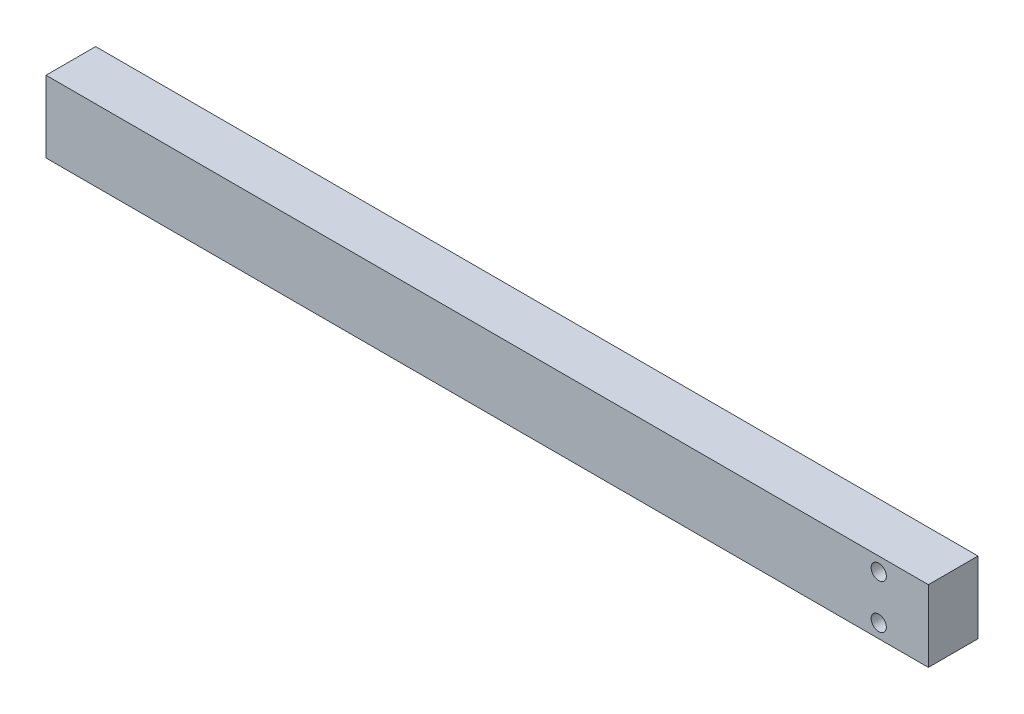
SolidWorks part; units mm, degrees
ref_plane "Face" through (0, 0, 0) normal (0, 0, 1) x (1, 0, 0)
ref_plane "Dessus" through (0, 0, 0) normal (0, 1, 0) x (1, 0, 0)
ref_plane "Droite" through (0, 0, 0) normal (1, 0, 0) x (0, 0, -1)
sketch "Esquisse1" plane through (0, 0, 0) normal (0, 0, 1) x (1, 0, 0)
  line L1 (0, 0) -> (320, 0)
  line L2 (0, 0) -> (0, 26)
  line L3 (0, 26) -> (320, 26)
  line L4 (320, 0) -> (320, 26)
  dimension "D1" = 320
  dimension "D2" = 26
extrude "Extrusion1" add sketch "Esquisse1" along normal blind 18
hole_wizard "Dégagement M51" positions "Esquisse3" profile "Esquisse2" hole size "M5" standard "ISO"
sketch "Esquisse3" plane through (0, 0, 18) normal (0, 0, 1) x (1, 0, 0)
  line L0 (320, 26) -> (0, 26) construction
  line L1 (0, 0) -> (320, 0) construction
  line L2 (320, 0) -> (320, 26) construction
  point P0 (302, 5)
  point P1 (302, 21)
  dimension "D1" = 5
  dimension "D2" = 5
  dimension "D3" = 18
  dimension "D4" = 18
sketch "Esquisse2" plane through (302, 5, 18) normal (1, 0, 0) x (0, -1, 0)
  line L0 (0, 0) -> (0, 18)
  line L1 (0, 18) -> (2.75, 18)
  line L2 (2.75, 18) -> (2.75, 0)
  line L5 (2.75, 0) -> (0, 0)
  line L11 (0, -6.35) -> (0, 107.95) construction
  dimension "Diamètre du perçage jusqu'au prochain" = 5.5
  dimension "Profondeur du perçage jusqu'au prochain" = 18
hole_wizard "Trou taraudé M61" positions "Esquisse5" profile "Esquisse4" tap size "M6" standard "ISO"
sketch "Esquisse5" plane through (0, 0, 0) normal (-1, 0, 0) x (0, 0, 1)
  line L0 (0, 26) -> (0, 0) construction
  line L3 (18, 26) -> (0, 26) construction
  line L4 (18, 0) -> (0, 0) construction
  point P1 (9, 20)
  point P13 (9, 6)
  dimension "D1" = 9
  dimension "D2" = 9
  dimension "D3" = 6
  dimension "D4" = 6
sketch "Esquisse4" plane through (0, 20, 9) normal (0, 1, 0) x (0, 0, 1)
  line L0 (0, 0) -> (0, 21.5022)
  line L1 (0, 21.5022) -> (2.5, 20)
  line L2 (2.5, 20) -> (2.5, 0)
  line L5 (2.5, 0) -> (0, 0)
  line L10 (0, 21.5022) -> (-2.5, 20) construction
  line L11 (0, -6.35) -> (0, 107.95) construction
  dimension "Diamètre du trou pour taraudage" = 5
  dimension "Profondeur du trou pour taraudage" = 20
  dimension "Angle de pointe" = 118
